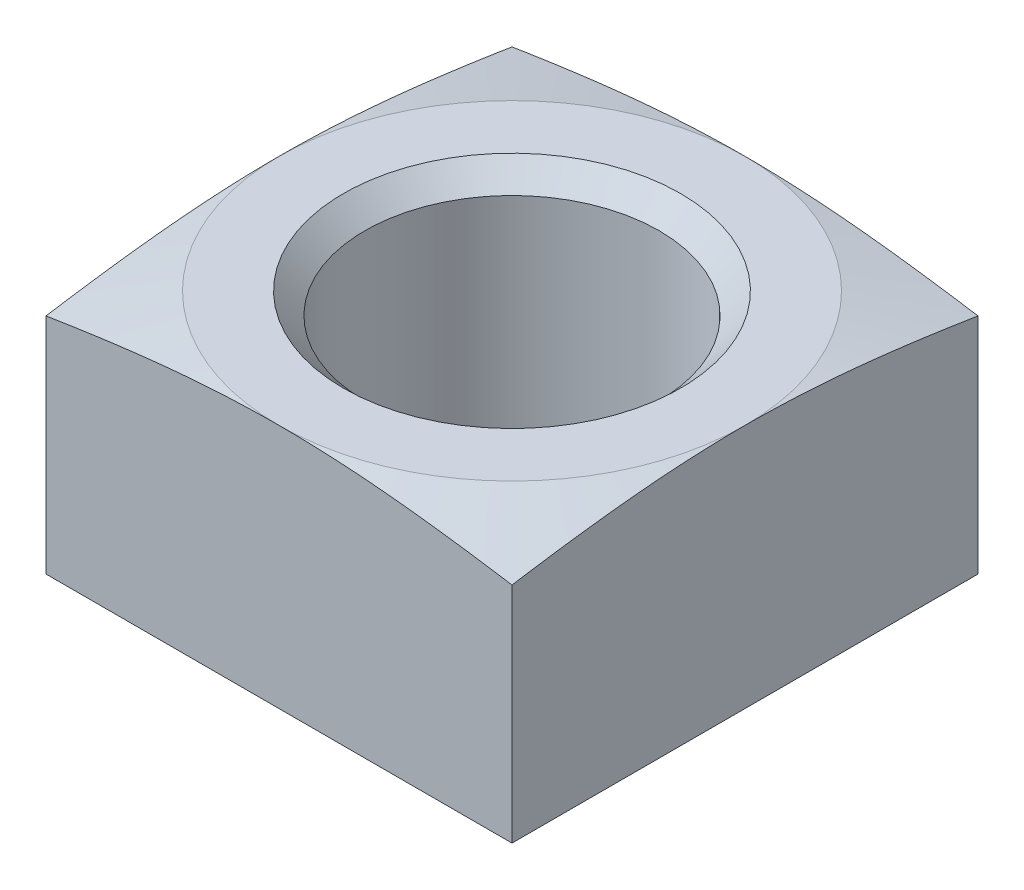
SolidWorks part; units mm, degrees
ref_plane "Front Plane" through (0, 0, 0) normal (0, 0, 1) x (1, 0, 0)
ref_plane "Top Plane" through (0, 0, 0) normal (0, 1, 0) x (1, 0, 0)
ref_plane "Right Plane" through (0, 0, 0) normal (1, 0, 0) x (0, 0, -1)
sketch "Sketch6" plane through (0, 0, 0) normal (1, 0, 0) x (0, 0, -1)
  line L0 (0, 59.8384) -> (0, -60.7908) construction
sketch "Sketch8" plane through (0, 0, 0) normal (1, 0, 0) x (0, 0, -1)
  line L1 (9.5, 5) -> (-9.5, 5)
  line L2 (9.5, 5) -> (9.5, -5)
  line L3 (9.5, -5) -> (-9.5, -5)
  line L4 (-9.5, 5) -> (-9.5, -5)
  line L5 (9.5, 5) -> (-9.5, -5) construction
  line L6 (9.5, -5) -> (-9.5, 5) construction
  point P0 (0, 0)
  dimension "D1" = 10
  dimension "D2" = 19
extrude "Boss-Extrude2" add sketch "Sketch8" along normal mid plane 19
sketch "Sketch10" plane through (0, 0, 0) normal (1, 0, 0) x (0, 0, -1)
  line L0 (-9.5, 5) -> (-13.5, 5)
  line L1 (-13.5, 5) -> (-13.5, 4.1)
  line L2 (-13.5, 4.1) -> (-9.5, 5)
  point P0 (-9.5, 5)
  point P6 (-9.5, 5)
  dimension "D1" = 0.9
  dimension "D2" = 4
revolve "Cut-Revolve1" cut sketch "Sketch10" angle 360 about L0
sketch "Sketch11" plane through (0, 5, 0) normal (0, 1, 0) x (1, 0, 0)
  circle A0 centre (0, 0) radius 6
  dimension "D1" = 12
extrude "Cut-Extrude1" cut sketch "Sketch11" against normal up to surface (10 mm away)
chamfer "Chamfer1" distance 0.875 angle 45 2 edges at (0, 5, 6) (0, -5, 6)
